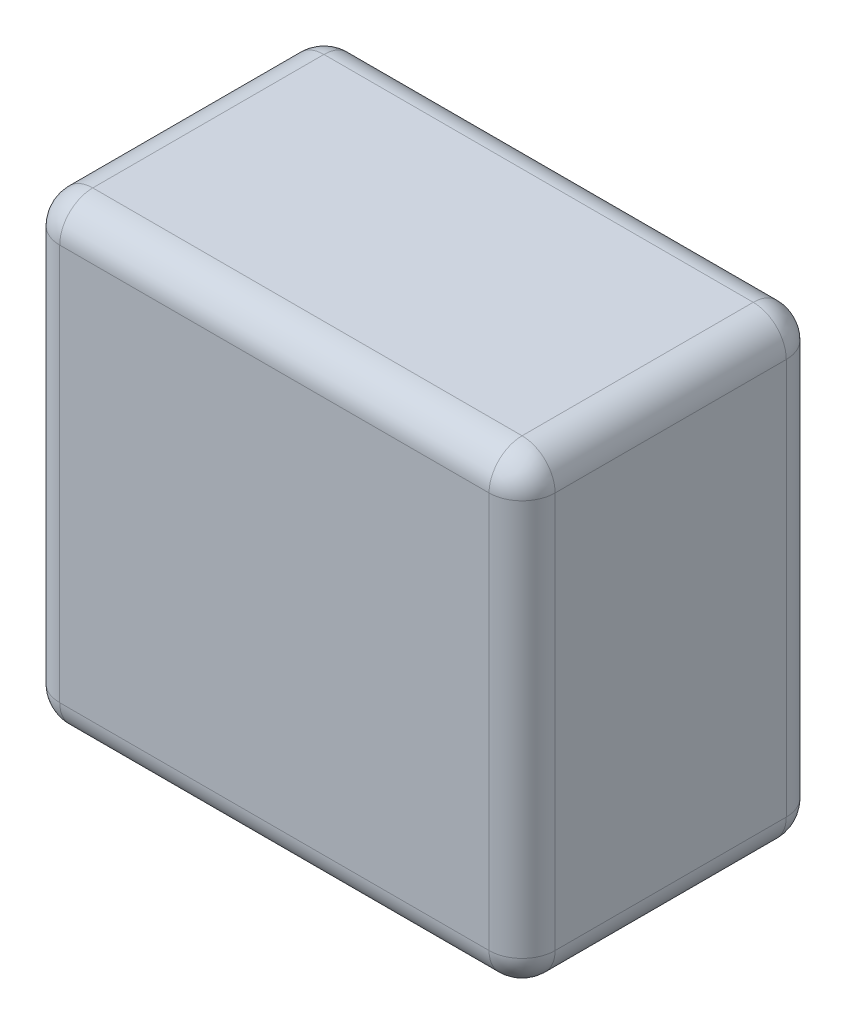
SolidWorks part; units mm, degrees
ref_plane "Front Plane" through (0, 0, 0) normal (0, 0, 1) x (1, 0, 0)
ref_plane "Top Plane" through (0, 0, 0) normal (0, 1, 0) x (1, 0, 0)
ref_plane "Right Plane" through (0, 0, 0) normal (1, 0, 0) x (0, 0, -1)
sketch "Sketch1" plane through (0, 0, 0) normal (0, 1, 0) x (1, 0, 0)
  line L1 (0, 0) -> (30, 0)
  line L2 (0, 0) -> (0, 18)
  line L3 (0, 18) -> (30, 18)
  line L4 (30, 0) -> (30, 18)
  dimension "D1" = 30
  dimension "D2" = 18
extrude "Boss-Extrude1" add sketch "Sketch1" along normal blind 28
fillet "Fillet1" radius 2 12 edges at (30, 28, -9) (15, 28, -18) (0, 28, -9) (15, 28, 0) (15, 0, 0) (30, 0, -9) (15, 0, -18) (0, 0, -9) (0, 14, -18) (0, 14, 0) (30, 14, -18) (30, 14, 0)
